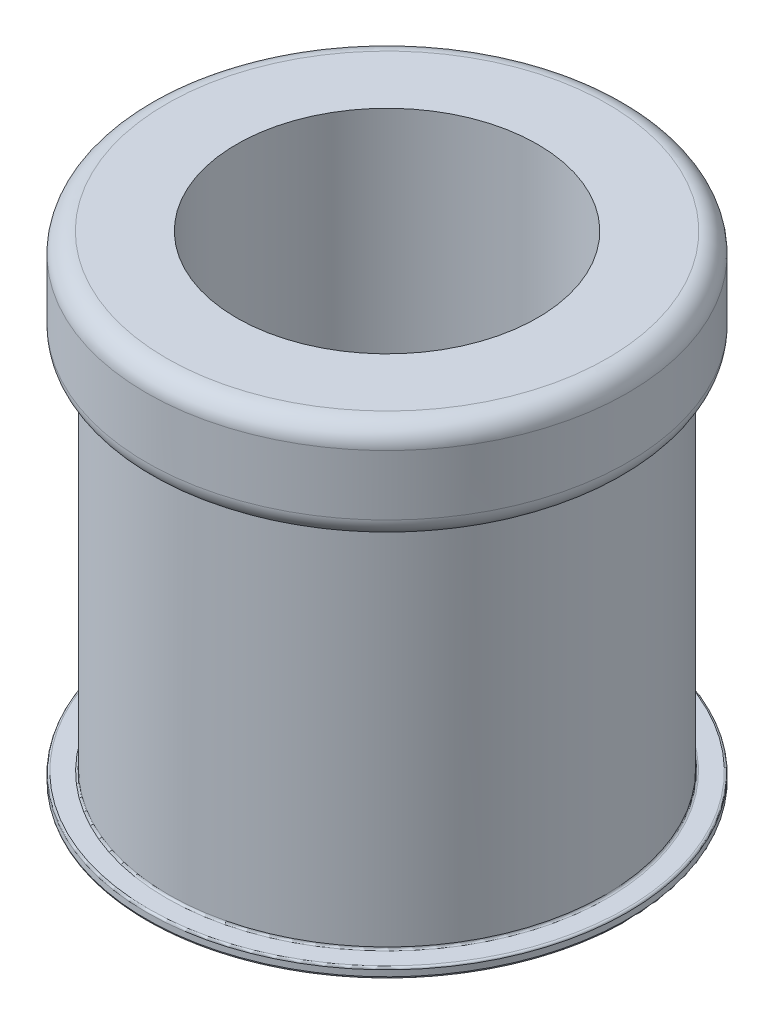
SolidWorks part; units mm, degrees
ref_plane "Front Plane" through (0, 0, 0) normal (0, 0, 1) x (1, 0, 0)
ref_plane "Top Plane" through (0, 0, 0) normal (0, 1, 0) x (1, 0, 0)
ref_plane "Right Plane" through (0, 0, 0) normal (1, 0, 0) x (0, 0, -1)
sketch "Sketch1" plane through (0, 0, 0) normal (1, 0, 0) x (0, 0, -1)
  line L0 (0, 0) -> (0, 63.8506) construction
  line L1 (0, 0) -> (15.2273, 0)
  line L2 (15.2273, 0) -> (15.2273, 0.635)
  line L3 (15.2273, 0.635) -> (13.8184, 0.635)
  line L4 (13.8184, 0.635) -> (13.8184, 23.9014)
  line L5 (13.8184, 23.9014) -> (15.2273, 23.9014)
  line L6 (15.2273, 23.9014) -> (15.2273, 30.2514)
  line L7 (15.2273, 30.2514) -> (0, 30.2514)
  line L8 (0, 30.2514) -> (0, 0)
  dimension "D1" = 30.4546
  dimension "D2" = 0.635
  dimension "D3" = 30.2514
  dimension "D4" = 6.35
revolve "Revolve1" add sketch "Sketch1" angle 360 about L0
fillet "Fillet1" radius 1.27 2 edges at (0, 30.2514, -15.2273) (0, 23.9014, -15.2273)
sketch "Sketch2" plane through (0, 30.2514, 0) normal (0, 1, 0) x (-1, 0, 0)
  circle A0 centre (0, 0) radius 9.525
  dimension "D1" = 19.05
extrude "Cut-Extrude1" cut sketch "Sketch2" against normal through all
fillet "Fillet2" radius 0.127 3 edges at (0, 0, -15.2273) (0, 0.635, -15.2273) (0, 0.635, -13.8184)
